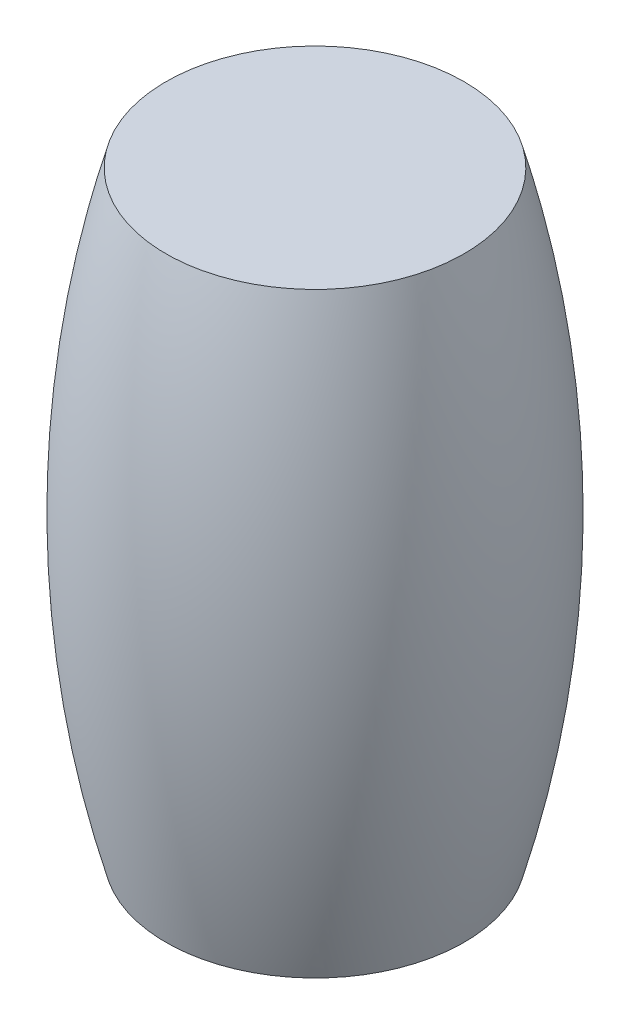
SolidWorks part; units mm, degrees
ref_plane "正面" through (0, 0, 0) normal (0, 0, 1) x (1, 0, 0)
ref_plane "平面" through (0, 0, 0) normal (0, 1, 0) x (1, 0, 0)
ref_plane "右側面" through (0, 0, 0) normal (1, 0, 0) x (0, 0, -1)
sketch "ｽｹｯﾁ1" plane through (0, 0, 0) normal (0, 0, 1) x (1, 0, 0)
  line L0 (0, 0) -> (0, 101.1566) construction
  line L1 (0, 0) -> (20, 0)
  line L2 (0, 80) -> (20, 80)
  line L3 (0, 80) -> (0, 0)
  arc A0 (20, 80) -> (20, 0) centre (-124.5683, 40) cw
  dimension "D3" = 150
  dimension "D1" = 80
  dimension "D2" = 40
revolve "回転1" add sketch "ｽｹｯﾁ1" angle 360 about L0
